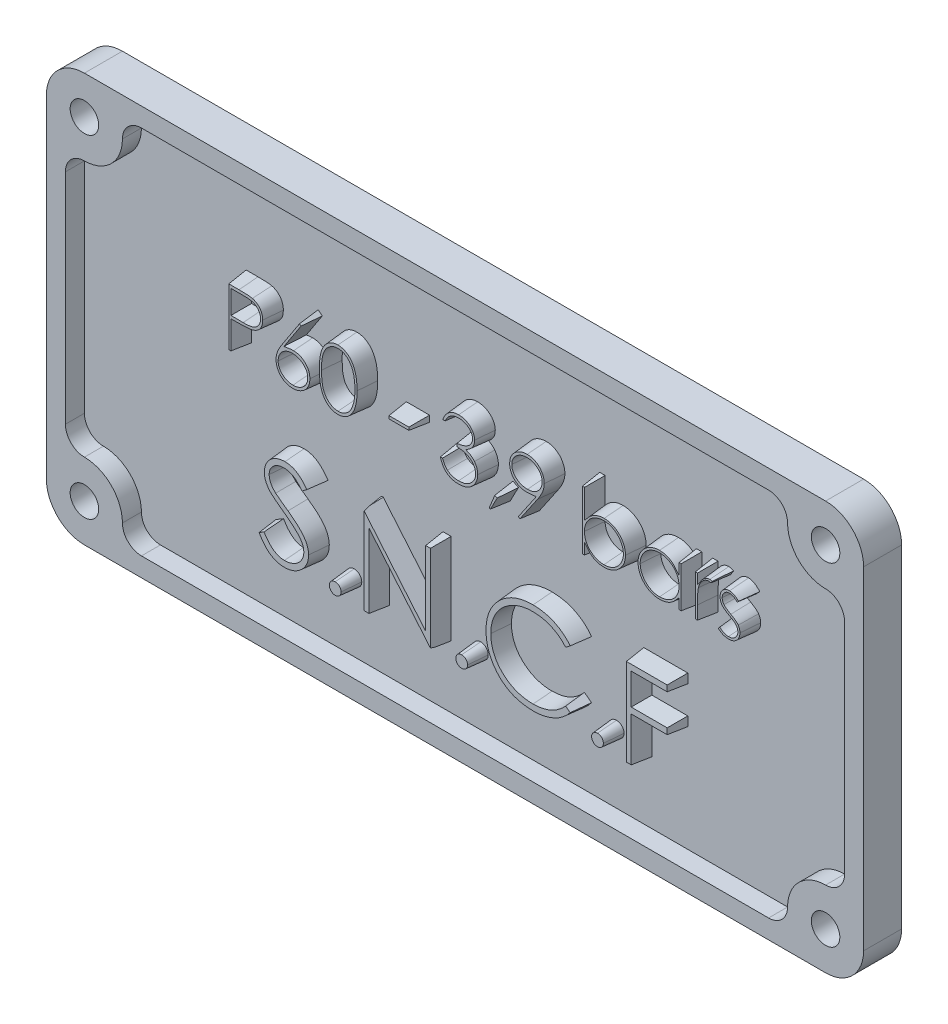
SolidWorks part; units mm, degrees
ref_plane "Plan1" through (0, 0, 0) normal (0, 0, 1) x (1, 0, 0)
ref_plane "Plan2" through (0, 0, 0) normal (0, 1, 0) x (1, 0, 0)
ref_plane "Plan3" through (0, 0, 0) normal (1, 0, 0) x (0, 0, -1)
sketch "Esquisse1" plane through (0, 0, 0) normal (0, 0, 1) x (1, 0, 0)
  line L1 (-70, -40) -> (16, -40)
  line L2 (-70, -40) -> (-70, 3)
  line L3 (-70, 3) -> (16, 3)
  line L4 (16, -40) -> (16, 3)
  dimension "D1" = 43
  dimension "D2" = 86
extrude "Base-Extrusion" add sketch "Esquisse1" along normal blind 4
sketch "Esquisse2" plane through (0, 0, 4) normal (0, 0, 1) x (1, 0, 0)
  line L0 (-66, 10) -> (-66, -50) construction
  line L1 (12, 10) -> (12, -50) construction
  line L2 (-80, -1) -> (40, -1) construction
  line L3 (-80, -36) -> (20, -36) construction
  line L4 (16, 3) -> (-70, 3) construction
  line L5 (-70, 3) -> (-70, -40) construction
  line L6 (-70, -40) -> (16, -40) construction
  line L7 (16, -40) -> (16, 3) construction
  circle A0 centre (-66, -1) radius 1.5
  circle A1 centre (12, -1) radius 1.5
  circle A2 centre (-66, -36) radius 1.5
  circle A3 centre (12, -36) radius 1.5
  dimension "D5" = 3
  dimension "D6" = 3
  dimension "D7" = 3
  dimension "D8" = 3
  dimension "D1" = 4
  dimension "D2" = 4
  dimension "D3" = 4
  dimension "D4" = 4
extrude "Enlèv. mat.-Extru.1" cut sketch "Esquisse2" against normal blind 4
sketch "Esquisse3" plane through (0, 0, 4) normal (0, 0, 1) x (1, 0, 0)
  line L0 (-60, -38) -> (6, -38)
  line L1 (-68, -7) -> (-68, -30)
  line L2 (6, 1) -> (-60, 1)
  line L3 (14, -7) -> (14, -30)
  line L4 (16, 3) -> (-70, 3) construction
  line L5 (-70, 3) -> (-70, -40) construction
  line L6 (-70, -40) -> (16, -40) construction
  line L7 (16, -40) -> (16, 3) construction
  arc A0 (-66, -5) -> (-62, -1) centre (-66, -1) ccw
  arc A1 (8, -1) -> (12, -5) centre (12, -1) ccw
  arc A2 (12, -32) -> (8, -36) centre (12, -36) ccw
  arc A3 (-62, -36) -> (-66, -32) centre (-66, -36) ccw
  arc A4 (-66, -5) -> (-68, -7) centre (-66, -7) ccw
  arc A5 (-62, -1) -> (-60, 1) centre (-60, -1) cw
  arc A6 (-66, -32) -> (-68, -30) centre (-66, -30) cw
  arc A7 (-62, -36) -> (-60, -38) centre (-60, -36) ccw
  arc A8 (6, -38) -> (8, -36) centre (6, -36) ccw
  arc A9 (12, -32) -> (14, -30) centre (12, -30) ccw
  arc A10 (8, -1) -> (6, 1) centre (6, -1) ccw
  arc A11 (12, -5) -> (14, -7) centre (12, -7) cw
  dimension "D1" = 8
  dimension "D2" = 8
  dimension "D3" = 8
  dimension "D4" = 8
  dimension "D9" = 2
  dimension "D5" = 2
  dimension "D6" = 2
  dimension "D7" = 2
  dimension "D8" = 2
extrude "Enlèv. mat.-Extru.2" cut sketch "Esquisse3" against normal blind 2
fillet "Congé1" radius 4 4 edges at (-70, 3, 2) (16, 3, 2) (16, -40, 2) (-70, -40, 2)
sketch "Esquisse4" plane through (0, 0, 2) normal (0, 0, 1) x (1, 0, 0)
  line L0 (-51.7882, -14.7806) -> (3.8701, -14.7806)
  line L1 (-48.0907, -31.4488) -> (-5.1837, -31.4488)
sketch "Esquisse5"
extrude "Extrusion1" add sketch "Esquisse5" along normal blind 2 draft 5
